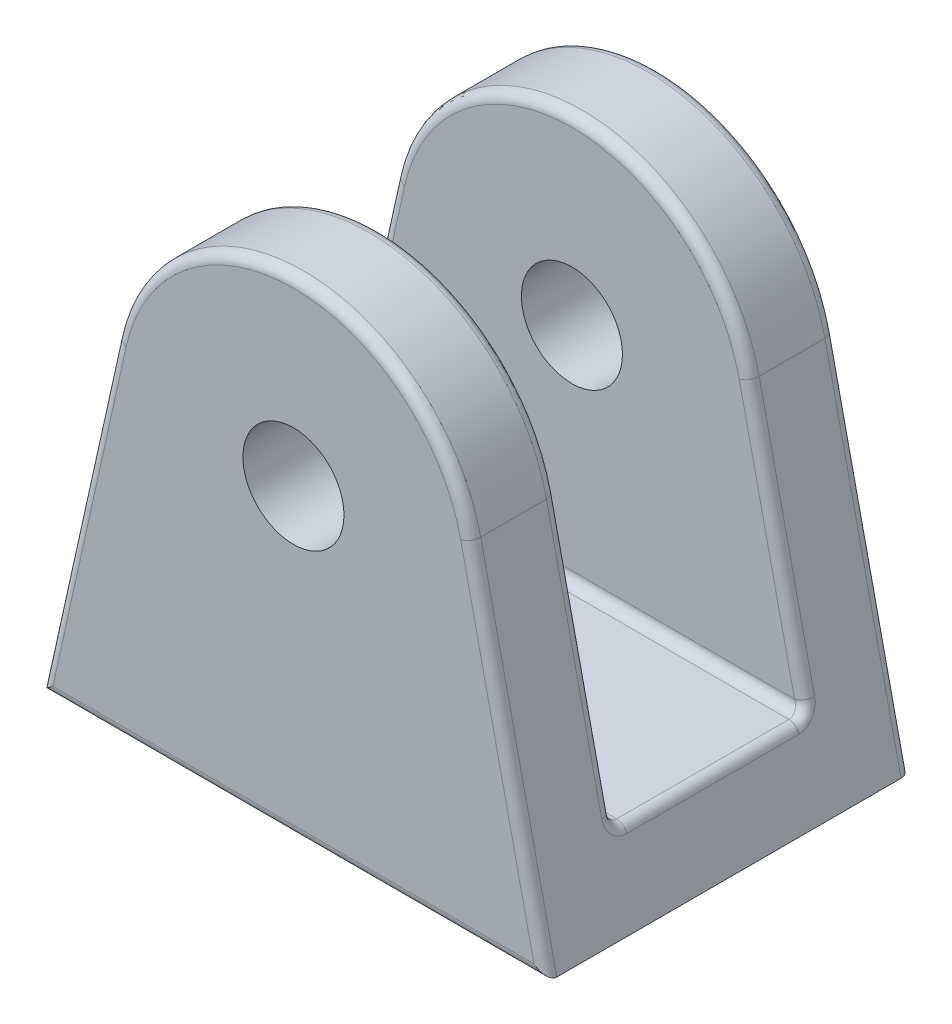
SolidWorks part; units mm, degrees
ref_plane "Front Plane" through (0, 0, 0) normal (0, 0, 1) x (1, 0, 0)
ref_plane "Top Plane" through (0, 0, 0) normal (0, 1, 0) x (1, 0, 0)
ref_plane "Right Plane" through (0, 0, 0) normal (1, 0, 0) x (0, 0, -1)
sketch "Sketch1"
  dimension "D2" = 30
  dimension "D1" = 50
  dimension "D3" = 25
extrude "Extrude1" add sketch "Sketch1" along normal mid plane 36
sketch "Sketch2"
  dimension "D1" = 19
  dimension "D2" = 50
  dimension "D3" = 8
extrude "Extrude3" cut sketch "Sketch2" along normal through all
fillet "Fillet1" radius 1 17 edges at (25, 47.9142, -9.5) (4.642, 20.9387, -9.5) (45.358, 20.9387, -9.5) (1.7736, 8, 0) (48.2264, 8, 0) (3.7552, 16.9387, -18) (25, 47.9142, -18) (4.642, 20.9387, 9.5) (45.358, 20.9387, 9.5) (46.2448, 16.9387, 18) (25, 47.9142, 18) (46.2448, 16.9387, -18) (25, 8, -9.5) (25, 8, 9.5) (25, 47.9142, 9.5) (3.7552, 16.9387, 18) (25, 0, 18)
sketch "Sketch3"
extrude "Extrude4" cut sketch "Sketch3" against normal through all
